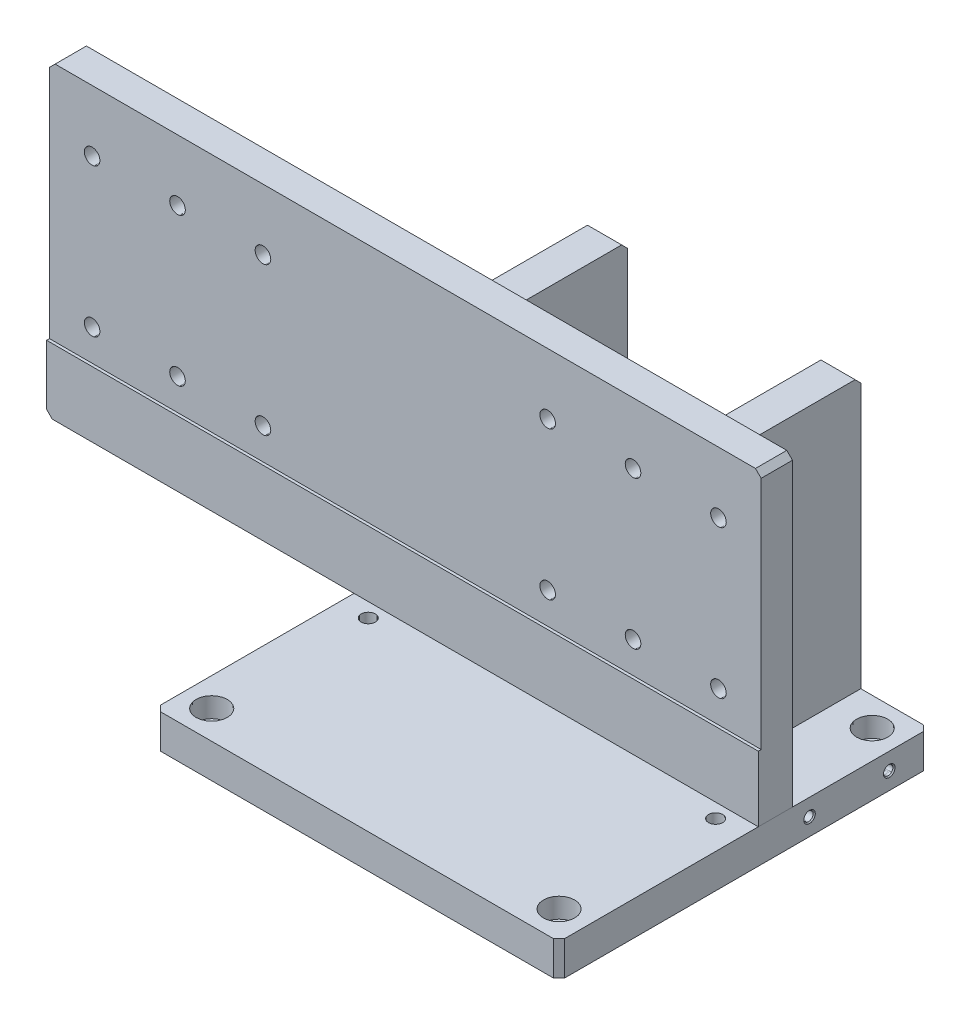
SolidWorks part; units mm, degrees
ref_plane "정면" through (0, 0, 0) normal (0, 0, 1) x (1, 0, 0)
ref_plane "윗면" through (0, 0, 0) normal (0, 1, 0) x (1, 0, 0)
ref_plane "우측면" through (0, 0, 0) normal (1, 0, 0) x (0, 0, -1)
sketch "스케치1" plane through (0, 0, 0) normal (0, 1, 0) x (1, 0, 0)
  line L1 (-71, 65) -> (71, 65)
  line L2 (-71, 65) -> (-71, -65)
  line L3 (-71, -65) -> (71, -65)
  line L4 (71, 65) -> (71, -65)
  line L5 (-71, 65) -> (71, -65) construction
  line L6 (-71, -65) -> (71, 65) construction
  point P0 (0, 0)
  dimension "D1" = 142
  dimension "D2" = 130
extrude "보스-돌출1" add sketch "스케치1" along normal blind 12
sketch "스케치2" plane through (0, 12, 0) normal (0, 1, 0) x (1, 0, 0)
  line L0 (71, -65) -> (71, 65) construction
  line L1 (71, 17) -> (-179, 17)
  line L2 (71, 17) -> (71, 5)
  line L3 (71, 5) -> (-179, 5)
  line L4 (-179, 17) -> (-179, 5)
  line L5 (71, 65) -> (-71, 65) construction
  dimension "D1" = 250
  dimension "D2" = 12
  dimension "D3" = 48
extrude "보스-돌출2" add sketch "스케치2" along normal blind 107.5 separate body
sketch "스케치3" plane through (0, 12, 0) normal (0, 1, 0) x (1, 0, 0)
  line L0 (71, 65) -> (-71, 65) construction
  line L1 (-47, 65) -> (-35, 65)
  line L2 (-47, 65) -> (-47, 17)
  line L3 (-47, 17) -> (-35, 17)
  line L4 (-35, 65) -> (-35, 17)
  line L5 (71, 17) -> (-179, 17) construction
  line L6 (-71, 65) -> (-71, -65) construction
  line L7 (35, 65) -> (47, 65)
  line L8 (35, 65) -> (35, 17)
  line L9 (35, 17) -> (47, 17)
  line L10 (47, 65) -> (47, 17)
  dimension "D1" = 24
  dimension "D2" = 12
  dimension "D3" = 70
extrude "보스-돌출3" add sketch "스케치3" along normal blind 95 separate body
hole_wizard "M6 소켓 머리 캡 나사용 카운터보어1" positions "스케치4" profile "스케치5" counterbore size "M6" standard "KS"
sketch "스케치4" plane through (0, 12, 0) normal (0, 1, 0) x (1, 0, 0)
  line L0 (-71, -65) -> (71, -65) construction
  line L2 (71, -65) -> (71, 65) construction
  point P0 (-61, 55)
  point P2 (61, 55)
  point P4 (-61, -55)
  point P6 (61, -55)
  dimension "D1" = 110
  dimension "D2" = 10
  dimension "D3" = 122
  dimension "D4" = 10
sketch "스케치5" plane through (-61, 12, -55) normal (1, 0, 0) x (0, 0, 1)
  line L0 (0, 0) -> (0, 12)
  line L1 (0, 12) -> (3.3, 12)
  line L3 (3.3, 12) -> (3.3, 7)
  line L4 (3.3, 7) -> (5.5, 7)
  line L5 (5.5, 7) -> (5.5, 0)
  line L7 (5.5, 0) -> (0, 0)
  line L11 (0, -6.35) -> (0, 107.95) construction
  dimension "관통 구멍 지름" = 6.6
  dimension "관통 구멍 깊이" = 12
  dimension "카운터보어 지름" = 11
  dimension "카운터보어 깊이" = 7
hole_wizard "Ø5.0mm 맞춤핀 구멍1" positions "스케치6" profile "스케치7" hole size "Ø5.0" standard "ISO"
sketch "스케치6" plane through (0, 12, 0) normal (0, 1, 0) x (1, 0, 0)
  line L0 (0, 0) -> (119.4915, 0) construction
  line L1 (71, -65) -> (71, 65) construction
  point P5 (61, 0)
  point P7 (-61, 0)
  dimension "D1" = 10
  dimension "D2" = 122
sketch "스케치7" plane through (-61, 12, 0) normal (1, 0, 0) x (0, 0, 1)
  line L0 (0, 0) -> (0, 12)
  line L1 (0, 12) -> (2.5, 12)
  line L2 (2.5, 12) -> (2.5, 0)
  line L5 (2.5, 0) -> (0, 0)
  line L11 (0, -6.35) -> (0, 107.95) construction
  dimension "관통 구멍 지름" = 5
  dimension "관통 구멍 깊이" = 12
sketch "스케치8" plane through (0, 0, -5) normal (0, 0, 1) x (1, 0, 0)
  line L0 (71, 119.5) -> (71, 12) construction
  line L1 (-179, 119.5) -> (71, 119.5)
  line L2 (-179, 119.5) -> (-179, 35)
  line L3 (-179, 35) -> (71, 35)
  line L4 (71, 119.5) -> (71, 35)
  line L5 (-71, 0) -> (71, 0) construction
  dimension "D1" = 35
extrude "컷-돌출1" cut sketch "스케치8" against normal blind 1
hole_wizard "M5 소켓 머리 캡 나사용 카운터보어1" positions "스케치9" profile "스케치10" counterbore size "M5" standard "KS"
sketch "스케치9" plane through (0, 0, -17) normal (0, 0, -1) x (-1, 0, 0)
  line L0 (-71, 119.5) -> (-71, 12) construction
  line L2 (-71, 119.5) -> (179, 119.5) construction
  point P0 (-56, 98)
  point P2 (-26, 98)
  point P4 (4, 98)
  point P6 (-56, 46)
  point P8 (-26, 46)
  point P10 (4, 46)
  dimension "D1" = 15
  dimension "D2" = 30
  dimension "D3" = 30
  dimension "D4" = 21.5
  dimension "D5" = 52
sketch "스케치10" plane through (56, 98, -17) normal (1, 0, 0) x (0, 1, 0)
  line L0 (0, 0) -> (0, 82)
  line L1 (0, 82) -> (2.75, 82)
  line L3 (2.75, 82) -> (2.75, 6)
  line L4 (2.75, 6) -> (4.75, 6)
  line L5 (4.75, 6) -> (4.75, 0)
  line L7 (4.75, 0) -> (0, 0)
  line L11 (0, -6.35) -> (0, 107.95) construction
  dimension "관통 구멍 지름" = 5.5
  dimension "관통 구멍 깊이" = 82
  dimension "카운터보어 지름" = 9.5
  dimension "카운터보어 깊이" = 6
pattern_linear "선형 패턴1" count 2 spacing 160 along (-1, 0, 0) of "M5 소켓 머리 캡 나사용 카운터보어1"
hole_wizard "M4 나사 구멍1" positions "스케치11" profile "스케치12" tap size "M4" standard "ISO"
sketch "스케치11" plane through (71, 0, 0) normal (1, 0, 0) x (0, 0, -1)
  line L0 (65, 12) -> (65, 0) construction
  line L1 (-65, 0) -> (65, 0) construction
  point P0 (51, 6)
  point P2 (23, 6)
  dimension "D1" = 28
  dimension "D2" = 14
  dimension "D3" = 6
sketch "스케치12" plane through (71, 6, -51) normal (0, 1, 0) x (0, 0, -1)
  line L0 (0, 0) -> (0, 10.9914)
  line L1 (0, 10.9914) -> (1.65, 10)
  line L2 (1.65, 10) -> (1.65, 0.375)
  line L3 (1.65, 0.375) -> (2.025, 0)
  line L5 (2.025, 0) -> (0, 0)
  line L6 (-1.65, 0.375) -> (-2.025, 0) construction
  line L10 (0, 10.9914) -> (-1.65, 10) construction
  line L11 (0, -6.35) -> (0, 107.95) construction
  dimension "탭 드릴 지름" = 3.3
  dimension "탭 드릴 깊이" = 10
  dimension "표면 카운터싱크 지름" = 4.05
  dimension "표면 카운터싱크 각도" = 90
  dimension "드릴 각도" = 118
chamfer "모따기1" distance 2 angle 45 3 edges at (-179, 12, -11) (71, 119.5, -11.5) (-179, 119.5, -11.5)
sketch "스케치13" plane through (-47, 0, 0) normal (-1, 0, 0) x (0, 0, 1)
  line L0 (-65, 107) -> (-65, 105)
  line L1 (-65, 107) -> (-65, 12) construction
  line L2 (-65, 105) -> (-63, 107)
  line L3 (-65, 107) -> (-17, 107) construction
  line L4 (-63, 107) -> (-65, 107)
  dimension "D1" = 2
  dimension "D2" = 2
extrude "컷-돌출2" cut sketch "스케치13" against normal through all
chamfer "모따기2" distance 2 angle 45 4 edges at (71, 6, -65) (71, 6, 65) (-71, 6, 65) (-71, 6, -65)
